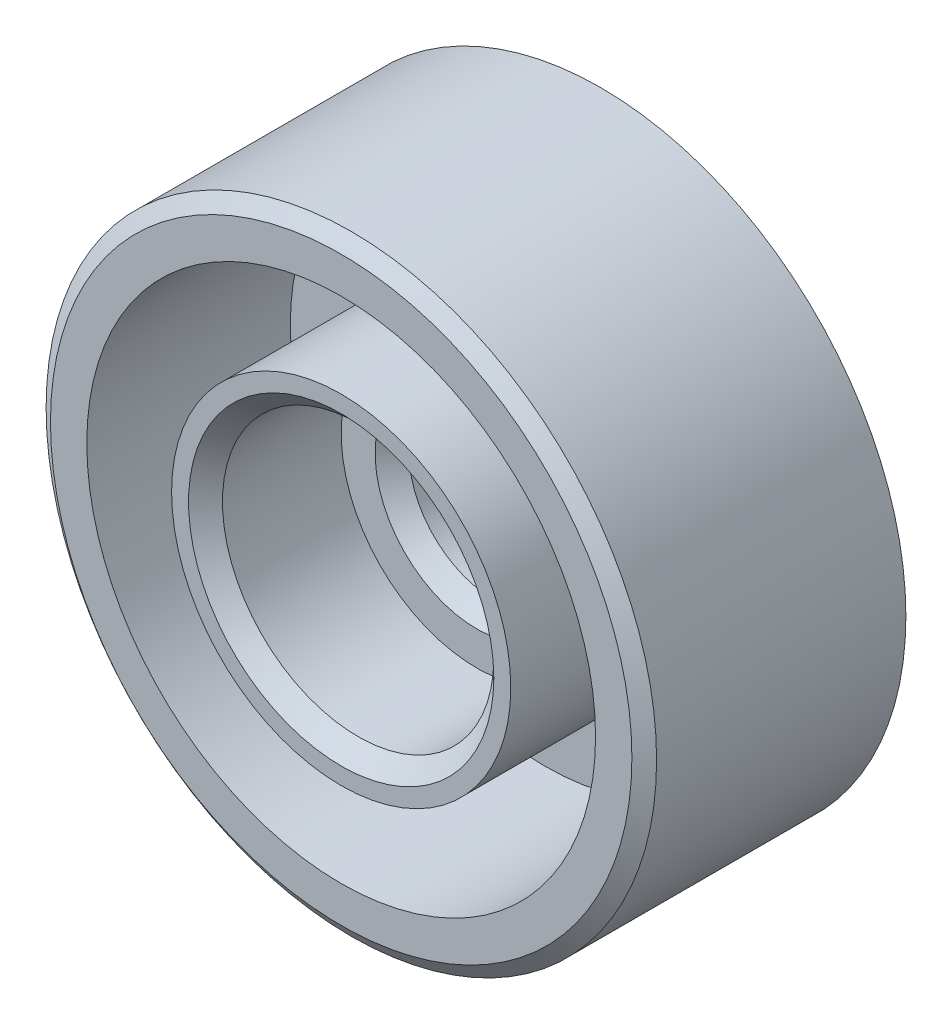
SolidWorks part; units mm, degrees
ref_plane "前视基准面" through (0, 0, 0) normal (0, 0, 1) x (1, 0, 0)
ref_plane "上视基准面" through (0, 0, 0) normal (0, 1, 0) x (1, 0, 0)
ref_plane "右视基准面" through (0, 0, 0) normal (1, 0, 0) x (0, 0, -1)
sketch "草图1" plane through (0, 0, 0) normal (0, 0, 1) x (1, 0, 0)
  circle A0 centre (0, 0) radius 9
  dimension "D2" = 18
extrude "凸台-拉伸1" add sketch "草图1" along normal blind 8
sketch "草图2" plane through (0, 0, 8) normal (0, 0, 1) x (1, 0, 0)
  circle A0 centre (0, 0) radius 4
  dimension "D1" = 8
extrude "切除-拉伸1" cut sketch "草图2" against normal blind 4
sketch "草图3" plane through (0, 0, 8) normal (0, 0, 1) x (1, 0, 0)
  circle A0 centre (0, 0) radius 5
  circle A1 centre (0, 0) radius 7.5
  dimension "D1" = 15
  dimension "D2" = 10
extrude "切除-拉伸2" cut sketch "草图3" against normal blind 6
hole_wizard "M6 螺纹孔8" positions "3D草图13" profile "草图15" tap size "M6" standard "ISO"
sketch3d "3D草图13"
  point P0 (0, 0, 0)
sketch "草图15" plane through (0, 0, 0) normal (1, 0, 0) x (0, 1, 0)
  line L0 (0, 0) -> (0, 8)
  line L1 (0, 8) -> (2.5, 8)
  line L2 (2.5, 8) -> (2.5, 0.525)
  line L3 (2.5, 0.525) -> (3.025, 0)
  line L5 (3.025, 0) -> (0, 0)
  line L6 (-2.5, 0.525) -> (-3.025, 0) construction
  line L11 (0, -6.35) -> (0, 107.95) construction
  dimension "通孔螺纹孔钻头直径" = 5
  dimension "通孔螺纹孔钻头深度" = 8
  dimension "近端锥形沉头孔直径" = 6.05
  dimension "近端锥形沉头孔角度" = 90
chamfer "倒角2" distance 0.5 angle 45 2 edges at (2.5, 0, 4) (4, 0, 8)
chamfer "倒角3" distance 0.5 angle 35 1 edges at (9, 0, 0)
chamfer "倒角4" distance 0.3 angle 55 1 edges at (9, 0, 8)
